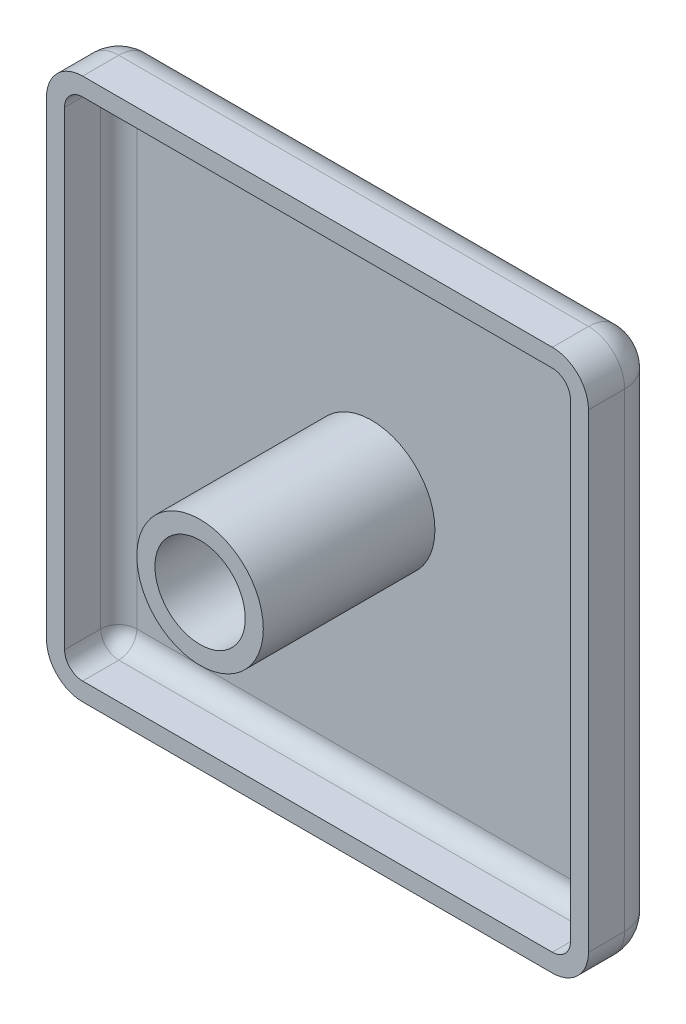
SolidWorks part; units mm, degrees
ref_plane "前视基准面" through (0, 0, 0) normal (0, 0, 1) x (1, 0, 0)
ref_plane "上视基准面" through (0, 0, 0) normal (0, 1, 0) x (1, 0, 0)
ref_plane "右视基准面" through (0, 0, 0) normal (1, 0, 0) x (0, 0, -1)
sketch "草图1" plane through (0, 0, 0) normal (0, 0, 1) x (1, 0, 0)
  line L1 (-15, 15) -> (15, 15)
  line L2 (-15, 15) -> (-15, -15)
  line L3 (-15, -15) -> (15, -15)
  line L4 (15, 15) -> (15, -15)
  dimension "D1" = 30
  dimension "D2" = 30
  dimension "D3" = 15
extrude "凸台-拉伸1" add sketch "草图1" along normal mid plane 4
fillet "圆角1" radius 2 8 edges at (15, 15, 0) (-15, 15, 0) (0, 15, -2) (-15, 0, -2) (15, -15, 0) (15, 0, -2) (0, -15, -2) (-15, -15, 0)
shell "抽壳1" thickness 1
sketch "草图2" plane through (0, 0, -1) normal (0, 0, 1) x (1, 0, 0)
  circle A0 centre (0, 0) radius 3.5
  circle A1 centre (0, 0) radius 2.5
  dimension "D1" = 5
extrude "凸台-拉伸2" add sketch "草图2" along normal blind 9.5
